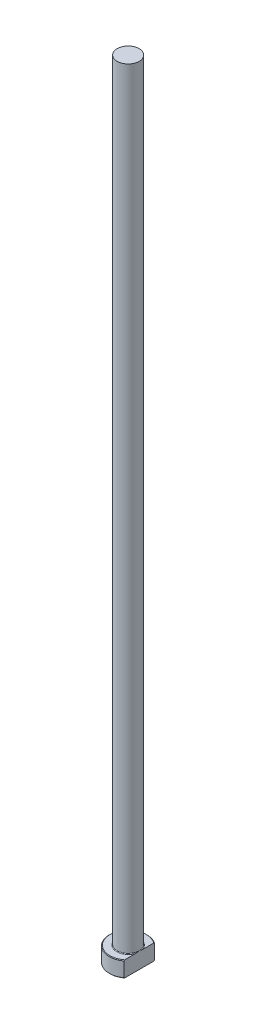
SolidWorks part; units mm, degrees
ref_plane "Front Plane" through (0, 0, 0) normal (0, 0, 1) x (1, 0, 0)
ref_plane "Top Plane" through (0, 0, 0) normal (0, 1, 0) x (1, 0, 0)
ref_plane "Right Plane" through (0, 0, 0) normal (1, 0, 0) x (0, 0, -1)
sketch "Sketch1" plane through (0, 0, 0) normal (0, 0, 1) x (1, 0, 0)
  line L0 (0, 259.9588) -> (0, -15.1925) construction
  line L1 (0, 0) -> (-6, 0)
  line L2 (-6, 0) -> (-6, 5)
  line L3 (-6, 5) -> (-3.5, 5)
  line L4 (-3.5, 5) -> (-3.5, 250)
  line L5 (-3.5, 250) -> (0, 250)
  line L6 (0, 250) -> (0, 0)
  dimension "L" = 250
  dimension "H" = 12
  dimension "T" = 5
  dimension "D" = 7
revolve "Revolve1" add sketch "Sketch1" angle 360 about L0
chamfer "Chamfer1" distance 0.2 angle 45 2 edges at (0, 5, 6) (0, 0, 6)
fillet "Fillet1" radius 0.2 1 edges at (0, 5, 3.5)
sketch "Sketch2" plane through (0, 0, 0) normal (0, 1, 0) x (1, 0, 0)
  line L0 (3.5, 4.8734) -> (3.5, -4.8734)
  circle A0 centre (0, 0) radius 6 construction
  arc A1 (3.5, -4.8734) -> (3.5, 4.8734) centre (0, 0) ccw
  circle A2 centre (0, 0) radius 3.5 construction
extrude "KEY" cut sketch "Sketch2" along normal through all
